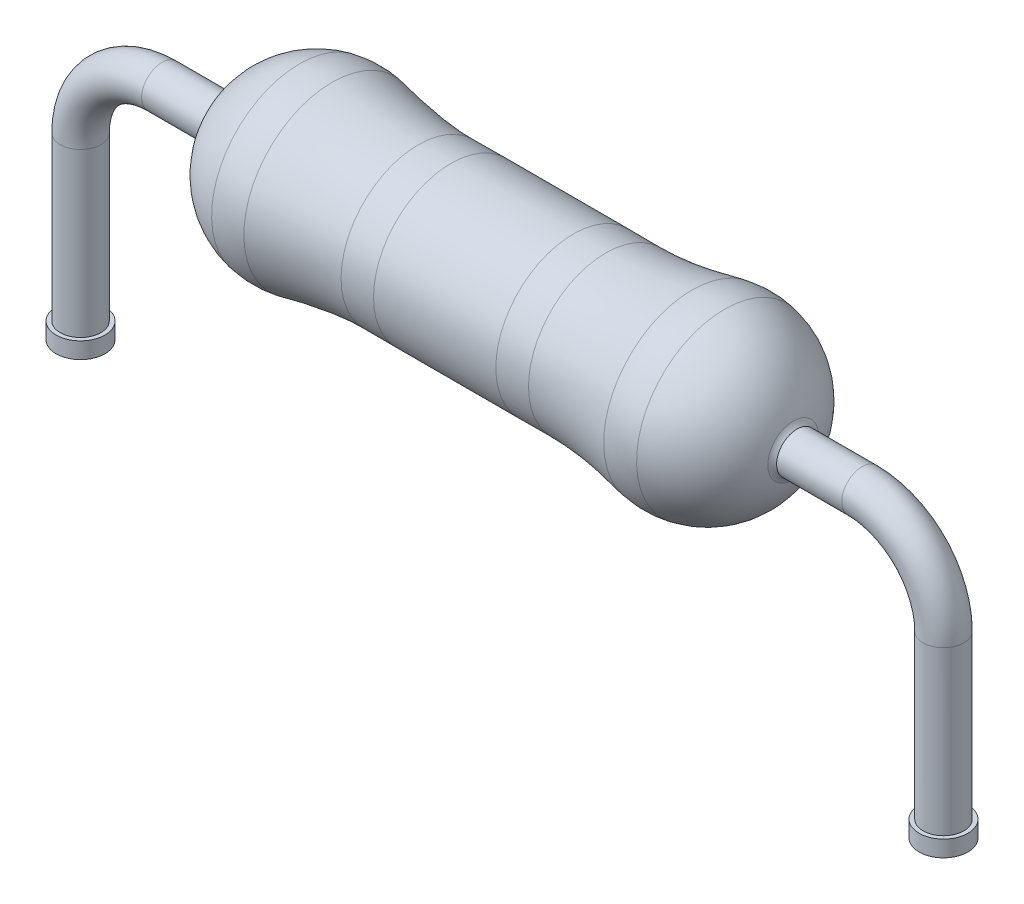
SolidWorks part; units mm, degrees
ref_plane "Front Plane" through (0, 0, 0) normal (0, 0, 1) x (1, 0, 0)
ref_plane "Top Plane" through (0, 0, 0) normal (0, 1, 0) x (1, 0, 0)
ref_plane "Right Plane" through (0, 0, 0) normal (1, 0, 0) x (0, 0, -1)
sketch "Sketch1" plane through (0, 0, 0) normal (0, 0, 1) x (1, 0, 0)
  line L0 (-3.5, 0) -> (3.5, 0) construction
  line L1 (3.5, 0) -> (3.5, 0.25)
  line L2 (0, 2.5431) -> (0, -1.0375) construction
  line L3 (0, 0.95) -> (3.7461, 0.95) construction
  line L4 (-0.7513, 0.95) -> (0.7513, 0.95)
  line L5 (-3.5, 0) -> (-3.5, 0.25)
  line L6 (-3.5, 0) -> (3.5, 0)
  line L7 (-6.2237, 0) -> (7.993, 0) construction
  arc A0 (-3.4548, 0.3122) -> (-2.2101, 1.0835) centre (-2.4, 0) cw
  arc A1 (3.4548, 0.3122) -> (2.2101, 1.0835) centre (2.4, 0) ccw
  spline S0 degree 2 poles (3.5, 0.25) (3.4713, 0.2767) (3.4548, 0.3122) knots 0 0 0 1 1 1
  spline S1 degree 3 poles (0.7513, 0.95) (0.9227, 0.9541) (1.4135, 0.928) (1.8981, 1.0175) (2.2101, 1.0835) knots 0 0 0 0 0.350784 1 1 1 1
  spline S2 degree 2 poles (-3.5, 0.25) (-3.4713, 0.2767) (-3.4548, 0.3122) knots 0 0 0 1 1 1
  spline S3 degree 3 poles (-0.7513, 0.95) (-0.9227, 0.9541) (-1.4135, 0.928) (-1.8981, 1.0175) (-2.2101, 1.0835) knots 0 0 0 0 0.350784 1 1 1 1
  dimension "D1" = 7
  dimension "D2" = 0.25
revolve "Revolve1" add sketch "Sketch1" angle 360 about L7
ref_plane "Plane1" through (0, 0, 2) normal (0, 0, 1) x (1, 0, 0)
sketch "Sketch2" plane through (0, 0, 2) normal (0, 0, 1) x (1, 0, 0)
  line L0 (0, 2.8244) -> (0, -3.3302) construction
  line L1 (-0.7513, 0.95) -> (-0.7513, -0.95) construction
  line L2 (-2.2101, 1.0835) -> (-2.2101, -1.0835) construction
  line L3 (0.7513, 0.95) -> (0.7513, -0.95) construction
  line L4 (2.2101, 1.0835) -> (2.2101, -1.0835) construction
  line L6 (2.2101, 2.9716) -> (2.6101, 2.9716)
  line L7 (2.2101, 2.9716) -> (2.2101, -2.4475)
  line L8 (2.2101, -2.4475) -> (2.6101, -2.4475)
  line L9 (2.6101, 2.9716) -> (2.6101, -2.4475)
  line L10 (0.7513, 2.9682) -> (1.1513, 2.9682)
  line L11 (0.7513, 2.9682) -> (0.7513, -2.4475)
  line L12 (0.7513, -2.4475) -> (1.1513, -2.4475)
  line L13 (1.1513, 2.9682) -> (1.1513, -2.4475)
  line L14 (-1.1513, 3.0104) -> (-0.7513, 3.0104)
  line L15 (-1.1513, 3.0104) -> (-1.1513, -2.5021)
  line L16 (-1.1513, -2.5021) -> (-0.7513, -2.5021)
  line L17 (-0.7513, 3.0104) -> (-0.7513, -2.5021)
  line L18 (-2.6101, 2.9976) -> (-2.2101, 2.9976)
  line L19 (-2.6101, 2.9976) -> (-2.6101, -2.5148)
  line L20 (-2.6101, -2.5148) -> (-2.2101, -2.5148)
  line L21 (-2.2101, 2.9976) -> (-2.2101, -2.5148)
  dimension "D1" = 0
  dimension "D2" = 0
  dimension "D3" = 0.4
  dimension "D4" = 0.4
  dimension "D5" = 0
  dimension "D6" = 0.4
  dimension "D7" = 0.4
  dimension "D8" = 0
sketch "Sketch3" plane through (-3.5, 0, 0) normal (-1, 0, 0) x (0, 0, 1)
  circle A0 centre (0, 0) radius 0.25
sketch "Sketch5" plane through (0, 0, 0) normal (0, 0, 1) x (1, 0, 0)
  line L0 (-3.5, 0) -> (-4.3, 0)
  line L1 (-5.3, -1) -> (-5.3, -3)
  arc A0 (-4.3, 0) -> (-5.3, -1) centre (-4.3, -1) ccw
  point P7 (-5.3, 0)
  dimension "D3" = 1
  dimension "D1" = 2
sweep "Sweep1" add profiles "Sketch3" path "Sketch5"
sketch "Sketch14" plane through (3.5, 0, 0) normal (1, 0, 0) x (0, 0, -1)
  circle A0 centre (0, 0) radius 0.25
sketch "Sketch15" plane through (0, 0, 0) normal (0, 0, 1) x (1, 0, 0)
  line L0 (3.5, 0) -> (4.3, 0)
  line L1 (5.3, -1) -> (5.3, -3)
  arc A0 (4.3, 0) -> (5.3, -1) centre (4.3, -1) cw
  point P7 (5.3, 0)
  dimension "D3" = 1
  dimension "D1" = 1.8
  dimension "D2" = 2
sweep "Sweep2" add profiles "Sketch14" path "Sketch15"
sketch "Sketch16" plane through (0, -3, 0) normal (0, -1, 0) x (1, 0, 0)
  circle A0 centre (-5.3, 0) radius 0.3
  dimension "D1" = 0.6
extrude "Boss-Extrude1" add sketch "Sketch16" along normal blind 0.2 contours A0
sketch "Sketch17" plane through (0, -3, 0) normal (0, -1, 0) x (1, 0, 0)
  circle A0 centre (5.3, 0) radius 0.3
  dimension "D1" = 0.6
extrude "Boss-Extrude2" add sketch "Sketch17" along normal blind 0.2
